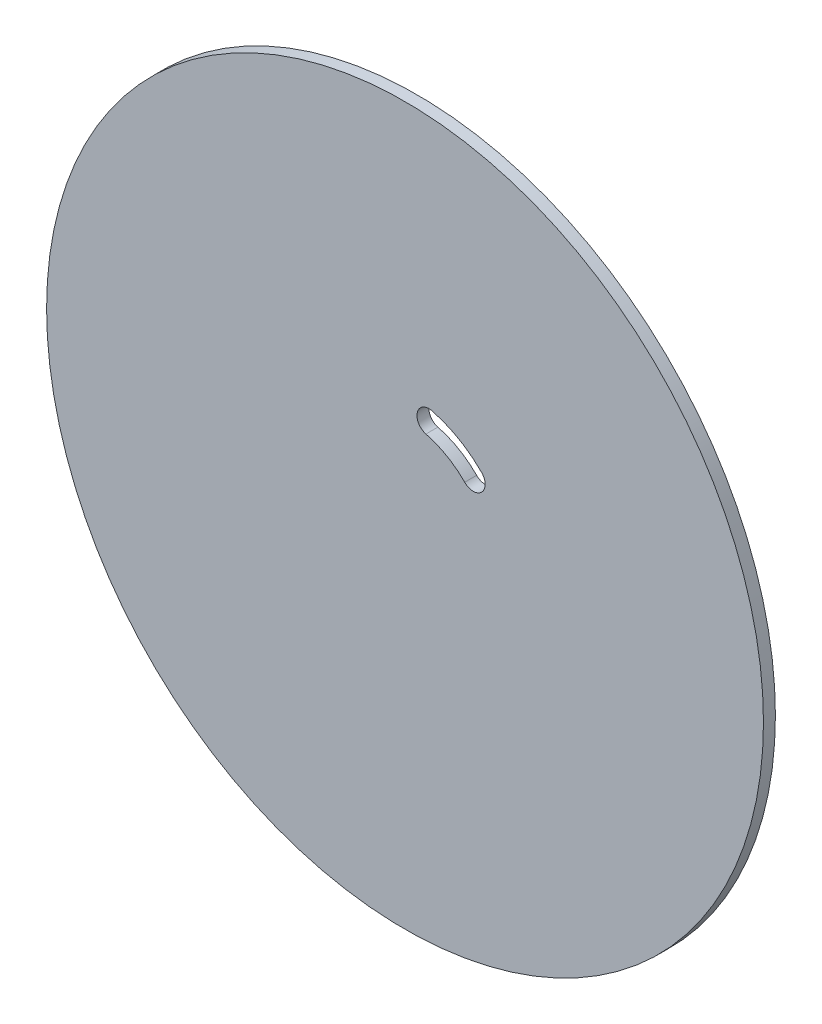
SolidWorks part; units mm, degrees
ref_plane "Front" through (0, 0, 0) normal (0, 0, 1) x (1, 0, 0)
ref_plane "Top" through (0, 0, 0) normal (0, 1, 0) x (1, 0, 0)
ref_plane "Right" through (0, 0, 0) normal (1, 0, 0) x (0, 0, -1)
sketch "Sketch1" plane through (0, 0, 0) normal (0, 0, 1) x (1, 0, 0)
  circle A0 centre (0, 0) radius 190.5
  dimension "D1" = 381
extrude "Extrude1" add sketch "Sketch1" along normal blind 6.35
sketch "Sketch2" plane through (0, 0, 6.35) normal (0, 0, 1) x (1, 0, 0)
  line L0 (0, 0) -> (190.5, 0) construction
  line L1 (0, 0) -> (0, 190.5) construction
  line L2 (0, 0) -> (164.9778, 95.25) construction
  line L3 (6.35, 10.9985) -> (161.8028, 100.7493) construction
  line L4 (6.35, 10.9985) -> (6.35, 190.5) construction
  line L5 (12.7, 49.1869) -> (36.2471, 35.592) construction
  line L6 (24.4735, 42.3894) -> (25.4, 43.9941) construction
  circle A0 centre (0, 0) radius 190.5 construction
  arc A1 (12.7, 49.1869) -> (36.2471, 35.592) centre (0, 0) cw construction
  arc A2 (11.1125, 43.0385) -> (31.7162, 31.143) centre (0, 0) cw
  arc A3 (14.2875, 55.3352) -> (40.778, 40.041) centre (0, 0) cw
  arc A4 (31.7162, 31.143) -> (40.778, 40.041) centre (36.2471, 35.592) ccw
  arc A5 (11.1125, 43.0385) -> (14.2875, 55.3352) centre (12.7, 49.1869) cw
  dimension "D4" = 6.35
  dimension "D1" = 30
  dimension "D3" = 50.8
  dimension "D2" = 6.35
extrude "Cut-Extrude1" cut sketch "Sketch2" against normal through all
